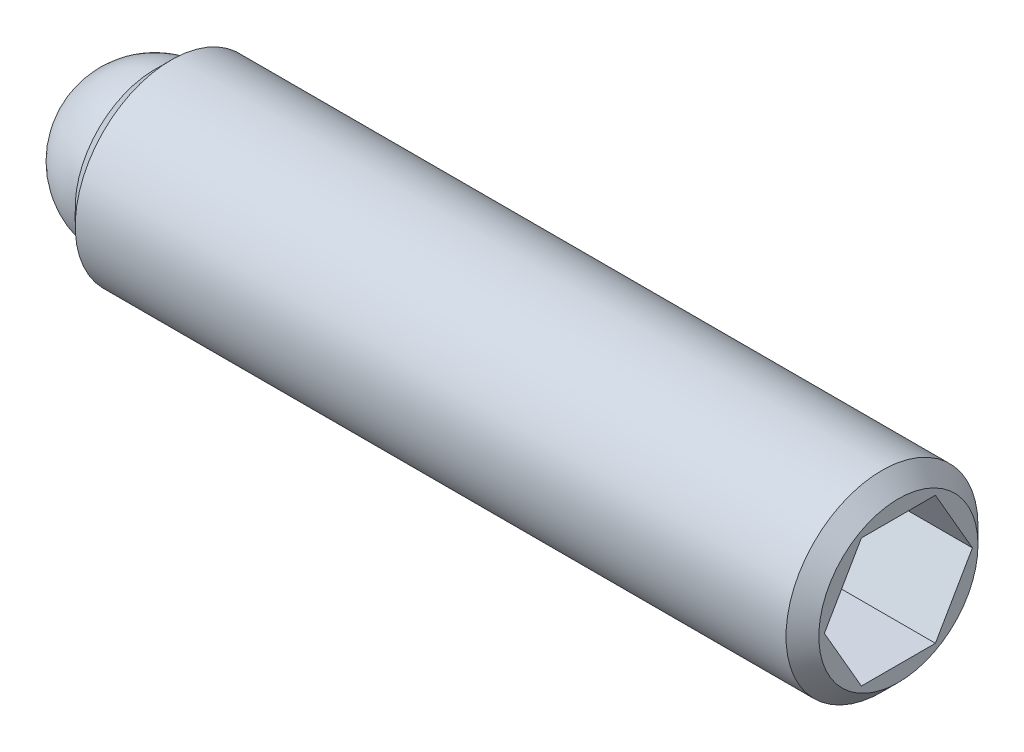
SolidWorks part; units mm, degrees
ref_plane "Front Plane" through (0, 0, 0) normal (0, 0, 1) x (1, 0, 0)
ref_plane "Top Plane" through (0, 0, 0) normal (0, 1, 0) x (1, 0, 0)
ref_plane "Right Plane" through (0, 0, 0) normal (1, 0, 0) x (0, 0, -1)
sketch "Sketch2" plane through (0, 0, 0) normal (1, 0, 0) x (0, 0, -1)
  circle A0 centre (0, 0) radius 1.4859
  dimension "D1" = 2.9718
extrude "Boss-Extrude1" add sketch "Sketch2" along normal blind 11.5094
sketch "Sketch3" plane through (0, 0, 0) normal (-1, 0, 0) x (0, 0, 1)
  circle A0 centre (0, 0) radius 1.1906
  dimension "D1" = 2.3813
chamfer "Chamfer1" distance 0.254 angle 45 1 edges at (0, 0, -1.4859)
chamfer "Chamfer2" distance 0.254 angle 45 1 edges at (11.5094, 0, -1.4859)
sketch "Sketch4" plane through (11.5094, 0, 0) normal (1, 0, 0) x (0, 0, -1)
  line L1 (1.1457, 0) -> (0.5728, 0.9922)
  line L2 (0.5728, 0.9922) -> (-0.5728, 0.9922)
  line L3 (-0.5728, 0.9922) -> (-1.1457, 0)
  line L4 (-1.1457, 0) -> (-0.5728, -0.9922)
  line L5 (-0.5728, -0.9922) -> (0.5728, -0.9922)
  line L6 (0.5728, -0.9922) -> (1.1457, 0)
  circle A0 centre (0, 0) radius 0.9922 construction
extrude "Cut-Extrude2" cut sketch "Sketch4" against normal blind 2.286
extrude "Cut-Extrude3" cut sketch "Sketch3" against normal blind 1.1906
sketch "Sketch5" plane through (0, 0, 0) normal (-1, 0, 0) x (0, 0, 1)
  line L0 (0, 0) -> (0, -1.1906)
  line L1 (0, 0) -> (0, 1.1906)
  arc A0 (0, 1.1906) -> (0, -1.1906) centre (0, 0) ccw
  dimension "D1" = 1.1906
revolve "Revolve1" add sketch "Sketch5" angle 360 about L1
